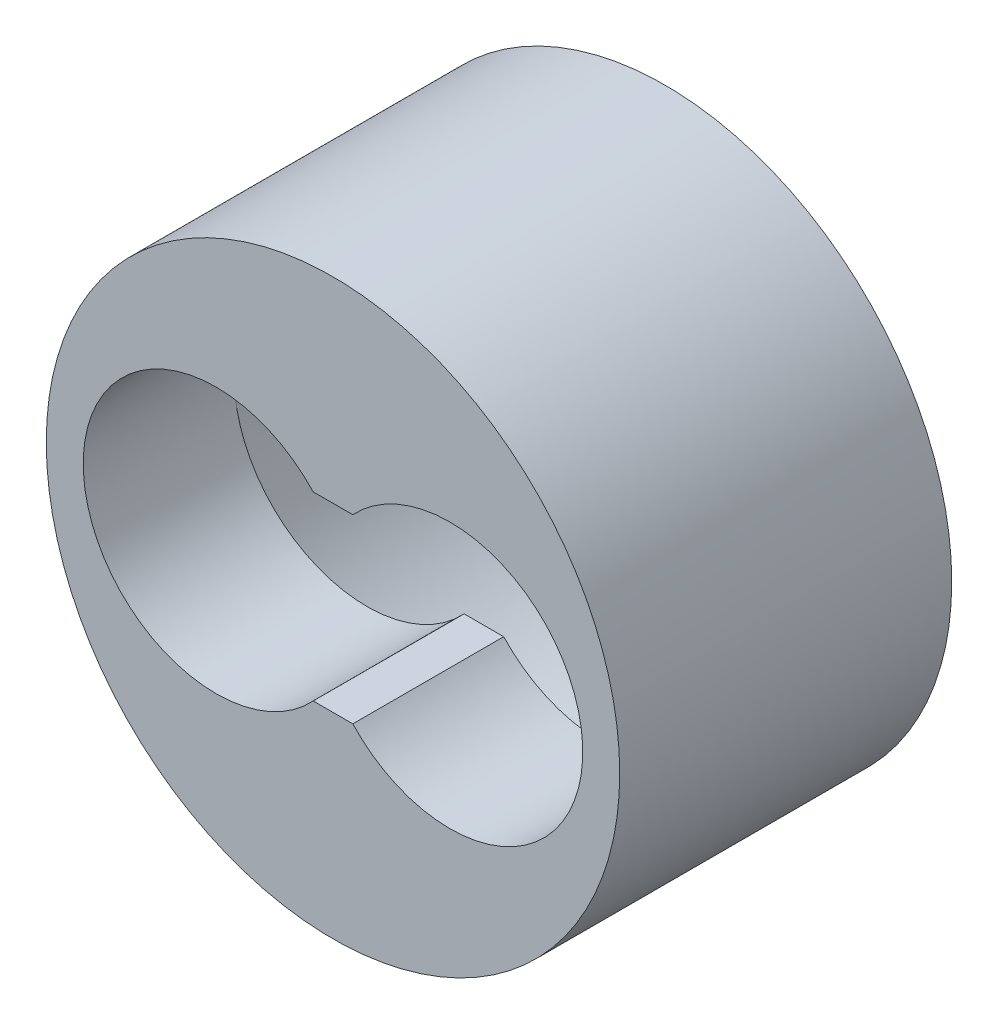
SolidWorks part; units mm, degrees
ref_plane "Front Plane" through (0, 0, 0) normal (1, 0, 0) x (0, 1, 0)
ref_plane "Top Plane" through (0, 0, 0) normal (0, 0, 1) x (0, 1, 0)
ref_plane "Right Plane" through (0, 0, 0) normal (0, 1, 0) x (-1, 0, 0)
sketch "Sketch1" plane through (0, 0, 0) normal (0, 0, 1) x (0, 1, 0)
  line L0 (0, -8.275) -> (0, 8.275) construction
  circle A0 centre (0, 0) radius 8.275 construction
  arc A1 (2.0843, 0) -> (-2.0843, 0) centre (0, 3.875) ccw
  arc A2 (-2.0843, 0) -> (2.0843, 0) centre (0, -3.875) ccw
  circle A3 centre (0, 0) radius 9.5
  dimension "D1" = 16.55
  dimension "D2" = 8.8
  dimension "D3" = 8.8
  dimension "D4" = 19
extrude "Boss-Extrude1" add sketch "Sketch1" along normal blind 5
sketch "Sketch2" plane through (0, 0, 0) normal (0, 0, 1) x (0, 1, 0)
  circle A0 centre (0, 0) radius 8.275
  circle A1 centre (0, 0) radius 9.5
  dimension "D1" = 16.55
  dimension "D2" = 19
extrude "Boss-Extrude2" add sketch "Sketch2" against normal blind 6
sketch "Sketch3" plane through (0, 0, 0) normal (0, 0, 1) x (0, 1, 0)
  line L0 (-10.6595, 0) -> (11.4113, 0) construction
  line L1 (-3, 1.5) -> (3, 1.5)
  line L2 (-3, 1.5) -> (-3, -1.5)
  line L3 (-3, -1.5) -> (3, -1.5)
  line L4 (3, 1.5) -> (3, -1.5)
  dimension "D1" = 1.5
  dimension "D2" = 3
  dimension "D3" = 6
  dimension "D4" = 3
extrude "Cut-Extrude1" cut sketch "Sketch3" along normal blind 10
